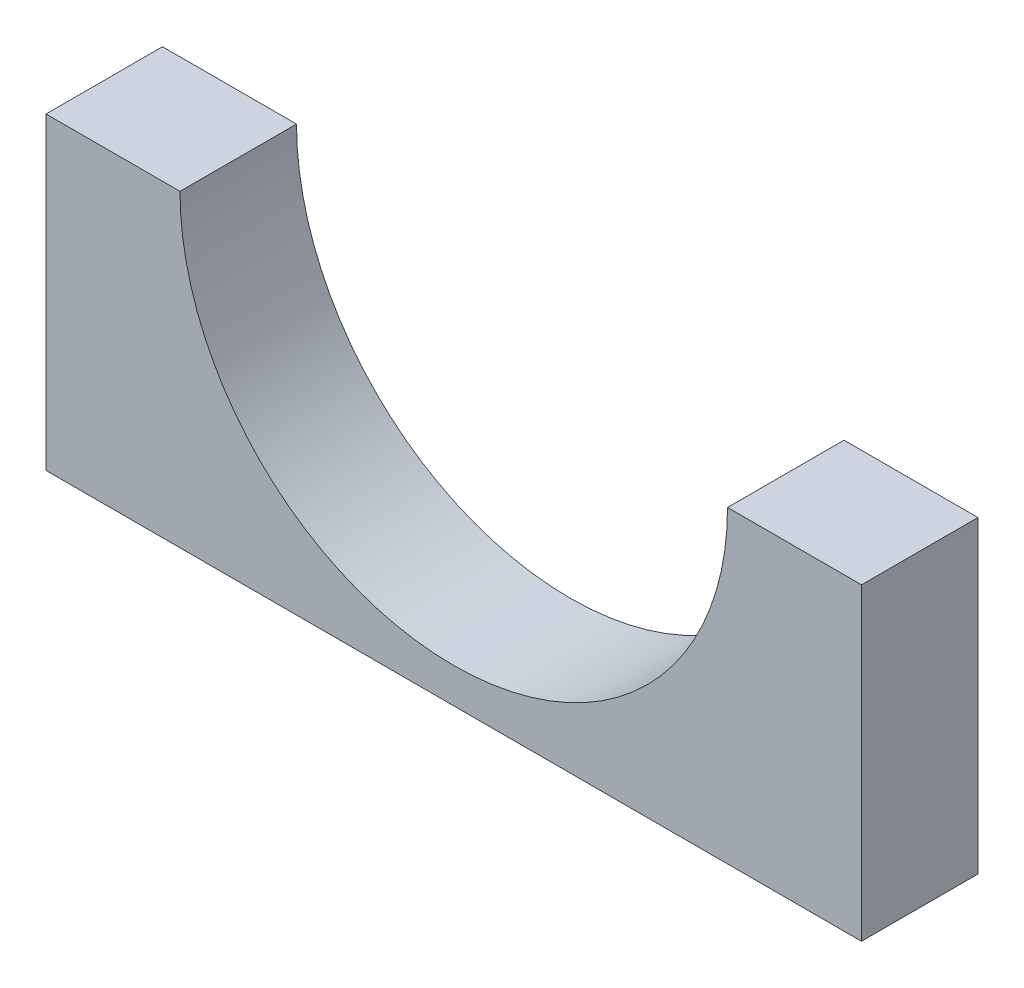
SolidWorks part; units mm, degrees
ref_plane "Plan de face" through (0, 0, 0) normal (0, 0, 1) x (1, 0, 0)
ref_plane "Plan de dessus" through (0, 0, 0) normal (0, 1, 0) x (1, 0, 0)
ref_plane "Plan de droite" through (0, 0, 0) normal (1, 0, 0) x (0, 0, -1)
sketch "Esquisse1" plane through (0, 0, 0) normal (0, 0, 1) x (1, 0, 0)
  line L0 (-50.5, -25) -> (-39, -25)
  line L1 (-39, -25) -> (-39, -51.5)
  line L2 (-39, -51.5) -> (-109, -51.5)
  line L3 (-109, -51.5) -> (-109, -25)
  line L4 (-109, -25) -> (-97.5, -25)
  arc A0 (-50.5, -25) -> (-97.5, -25) centre (-74, -25) cw
  arc A1 (-50.5, -25) -> (-97.5, -25) centre (-74, -25) ccw construction
extrude "Extrusion1" add sketch "Esquisse1" against normal up to surface (10 mm away)
